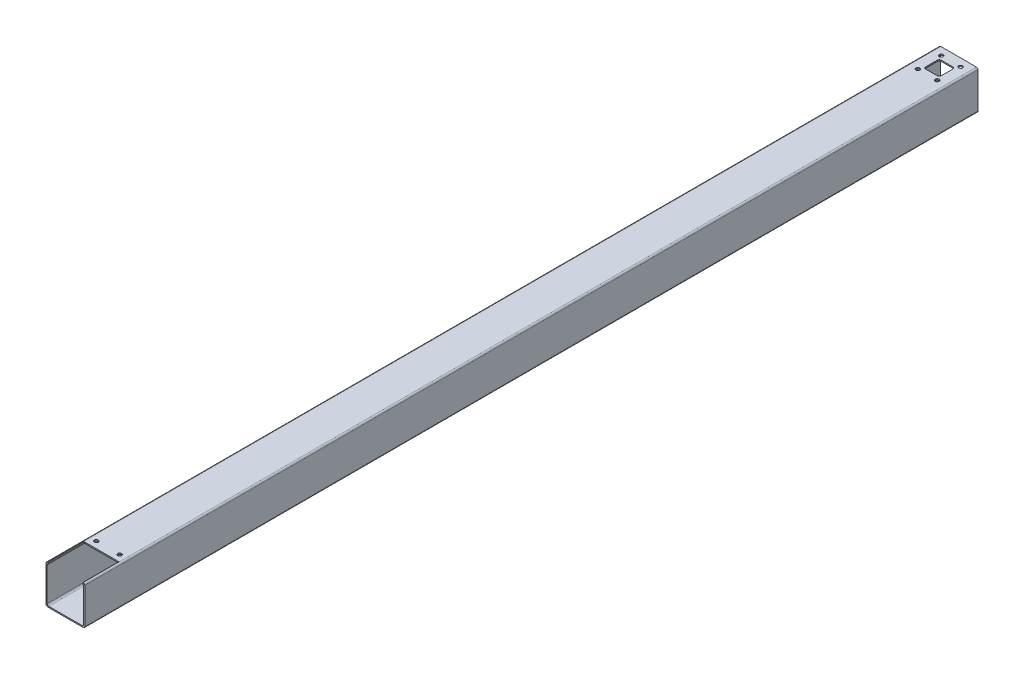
SolidWorks part; units mm, degrees
ref_plane "Plan de face" through (0, 0, 0) normal (0, 0, 1) x (1, 0, 0)
ref_plane "Plan de dessus" through (0, 0, 0) normal (0, 1, 0) x (1, 0, 0)
ref_plane "Plan de droite" through (0, 0, 0) normal (1, 0, 0) x (0, 0, -1)
sketch "Esquisse1" plane through (0, 0, 0) normal (0, 0, 1) x (1, 0, 0)
  line L1 (0, 0) -> (100, 0)
  line L2 (0, 0) -> (0, 100)
  line L3 (0, 100) -> (100, 100)
  line L4 (100, 0) -> (100, 100)
  dimension "D1" = 100
  dimension "D2" = 100
extrude "Extru.-Mince1" add sketch "Esquisse1" along normal blind 2304 thin
fillet "Congé1" radius 4 8 edges at (100, 0, 1152) (0, 0, 1152) (0, 100, 1152) (100, 100, 1152) (3, 3, 1152) (97, 3, 1152) (97, 97, 1152) (3, 97, 1152)
sketch "Esquisse2" plane through (0, 100, 0) normal (0, 1, 0) x (1, 0, 0)
  line L0 (96, -2304) -> (4, -2304) construction
  line L1 (5, -2211) -> (95, -2211)
  line L2 (5, -2211) -> (5, -2304)
  line L3 (5, -2304) -> (95, -2304)
  line L4 (95, -2211) -> (95, -2304)
  line L5 (100, 0) -> (100, -2304) construction
  line L6 (0, -2304) -> (0, 0) construction
  line L7 (96, 0) -> (4, 0) construction
  line L8 (70, -30) -> (30, -30)
  line L9 (70, -30) -> (70, -70)
  line L10 (70, -70) -> (30, -70)
  line L11 (30, -30) -> (30, -70)
  circle A0 centre (20, -2194) radius 5
  circle A1 centre (80, -2194) radius 5
  circle A2 centre (25, -80) radius 5
  circle A3 centre (75, -80) radius 5
  circle A4 centre (75, -20) radius 5
  circle A5 centre (25, -20) radius 5
  dimension "D5" = 20
  dimension "D13" = 10
  dimension "D1" = 0
  dimension "D2" = 5
  dimension "D3" = 90
  dimension "D4" = 93
  dimension "D6" = 20
  dimension "D7" = 110
  dimension "D8" = 110
  dimension "D9" = 40
  dimension "D10" = 40
  dimension "D11" = 30
  dimension "D12" = 30
  dimension "D14" = 10
  dimension "D15" = 5
  dimension "D16" = 5
  dimension "D17" = 5
  dimension "D18" = 5
  dimension "D19" = 10
  dimension "D20" = 10
extrude "Enlèv. mat.-Extru.1" cut sketch "Esquisse2" against normal blind 10
fillet "Congé2" radius 5 4 edges at (70, 98.5, 70) (70, 98.5, 30) (30, 98.5, 30) (30, 98.5, 70)
